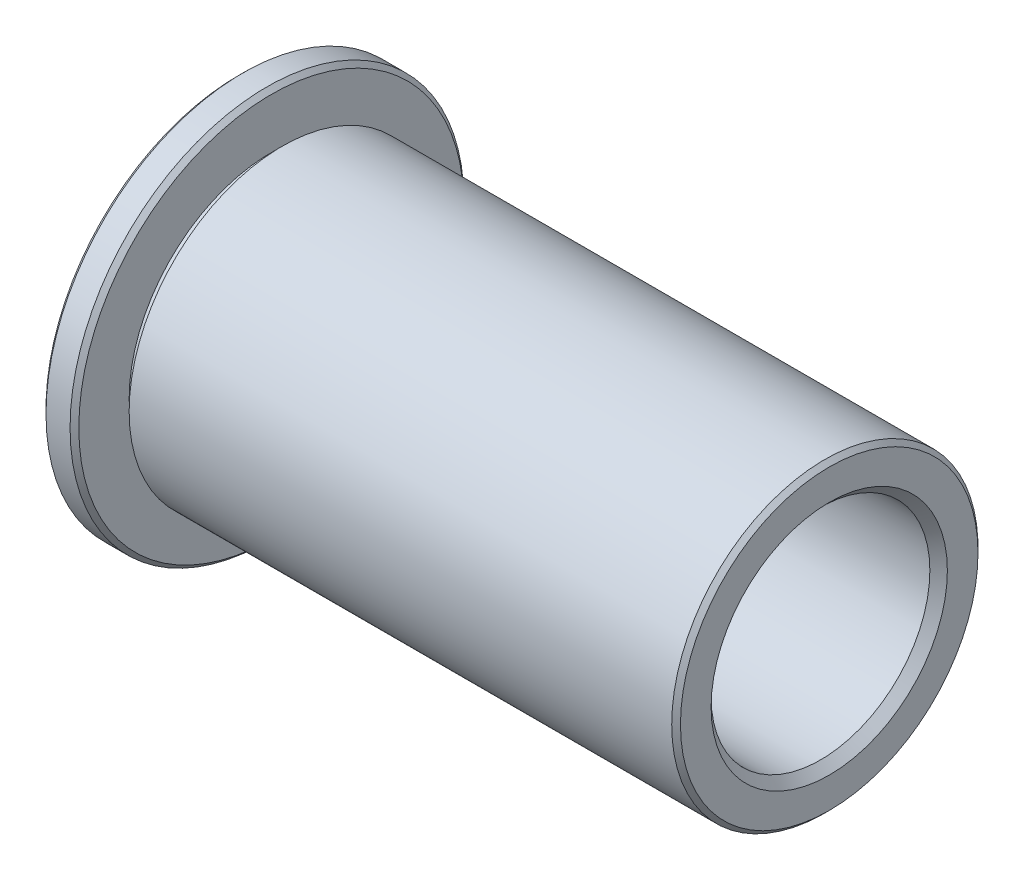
SolidWorks part; units mm, degrees
ref_plane "Plan de face" through (0, 0, 0) normal (0, 0, 1) x (1, 0, 0)
ref_plane "Plan de dessus" through (0, 0, 0) normal (0, 1, 0) x (1, 0, 0)
ref_plane "Plan de droite" through (0, 0, 0) normal (1, 0, 0) x (0, 0, -1)
sketch "Esquisse1" plane through (0, 0, 0) normal (0, 0, 1) x (1, 0, 0)
  line L1 (0, 9) -> (1.5, 9)
  line L2 (1.5, 9) -> (1.5, 6.5)
  line L3 (2, 7) -> (27, 7)
  line L4 (27, 7) -> (27, 5)
  line L5 (27, 5) -> (0, 5)
  line L8 (0, 0) -> (26.9213, 0) construction
  line L9 (0, 9) -> (0, 5)
  line L11 (1.5, 6.5) -> (2, 6.5)
  line L12 (2, 6.5) -> (2, 7)
  dimension "D1" = 10
  dimension "D2" = 14
  dimension "D3" = 18
  dimension "D4" = 1.5
  dimension "D5" = 27
  dimension "D6" = 0.5
  dimension "D7" = 0.5
  dimension "D8" = 25
revolve "Révolution1" add sketch "Esquisse1" angle 360 about L8
chamfer "Chanfrein1" distance 0.4 angle 45 2 edges at (0, 0, 5) (27, 0, 5)
chamfer "Chanfrein2" distance 0.2 angle 45 3 edges at (27, 0, 7) (0, 0, 9) (1.5, 0, 9)
